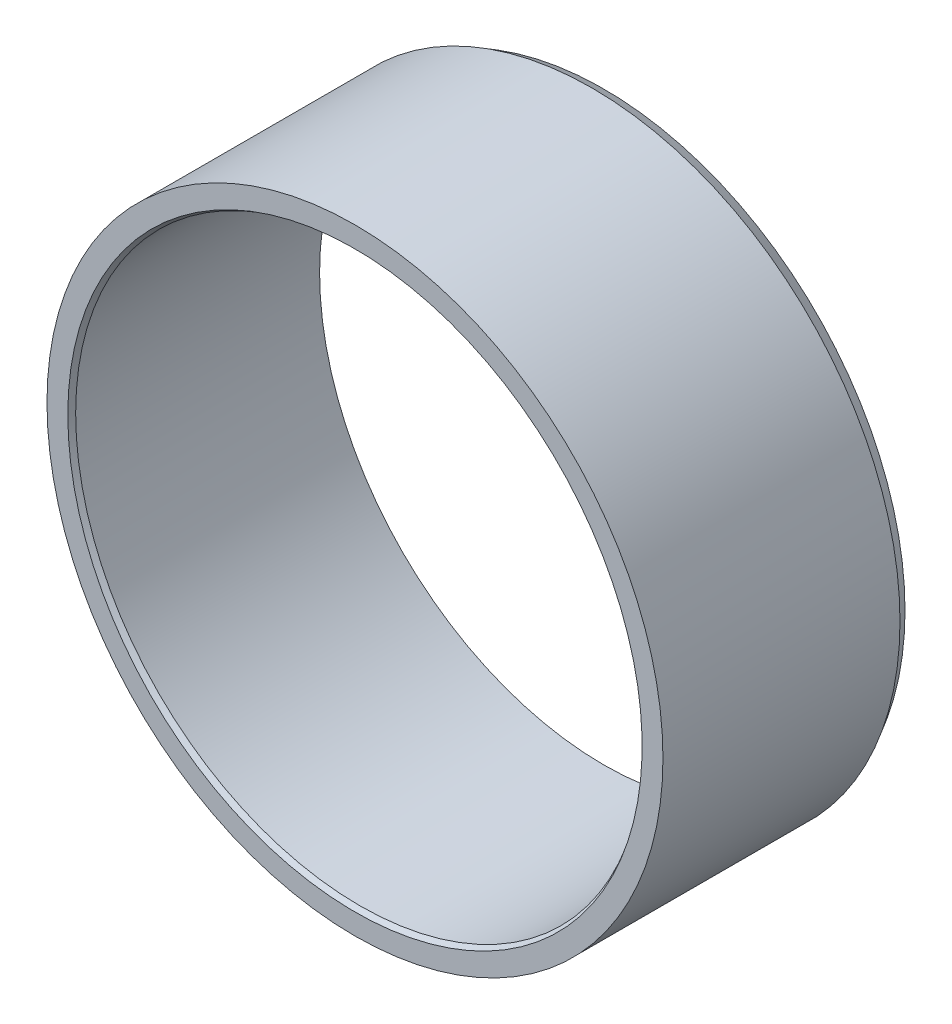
SolidWorks part; units mm, degrees
ref_plane "Front Plane" through (0, 0, 0) normal (0, 0, 1) x (1, 0, 0)
ref_plane "Top Plane" through (0, 0, 0) normal (0, 1, 0) x (1, 0, 0)
ref_plane "Right Plane" through (0, 0, 0) normal (1, 0, 0) x (0, 0, -1)
sketch "Sketch1" plane through (0, 0, 0) normal (1, 0, 0) x (0, 0, -1)
  line L0 (0, 0) -> (36.9951, 0) construction
  line L1 (0, 28.575) -> (0, 0) construction
  line L2 (-12.5095, 30.9562) -> (12.5095, 30.9563)
  line L3 (-12.5095, 30.9562) -> (-12.5095, 28.575)
  line L4 (-12.5095, 28.575) -> (12.5095, 28.575)
  line L5 (12.5095, 30.9563) -> (12.5095, 28.575)
  dimension "D1" = 57.15
  dimension "D2" = 61.9125
  dimension "D3" = 25.019
revolve "Revolve1" add sketch "Sketch1" angle 360 about L0
chamfer "Chamfer1" distance 0.5004 angle 30 1 edges at (28.575, 0, 12.5095)
chamfer "Chamfer2" distance 1.1938 angle 30 1 edges at (30.9563, 0, -12.5095)
